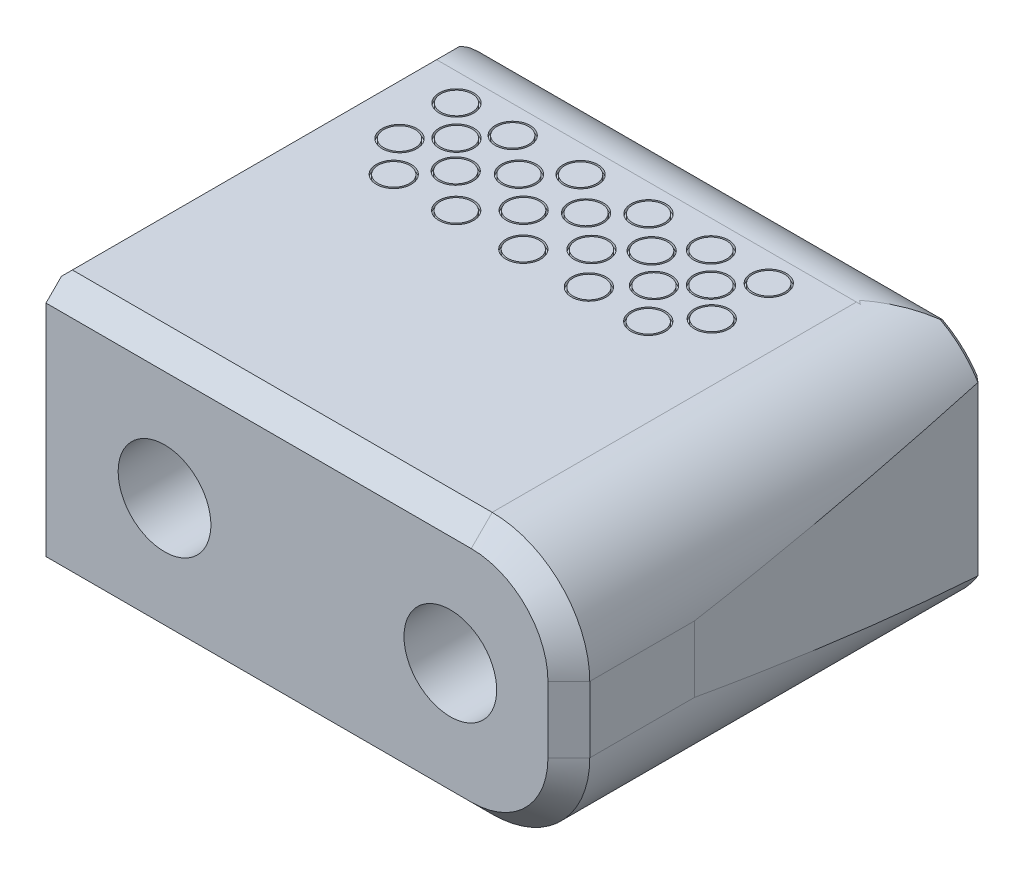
SolidWorks part; units mm, degrees
ref_plane "Front Plane" through (0, 0, 0) normal (0, 0, 1) x (1, 0, 0)
ref_plane "Top Plane" through (0, 0, 0) normal (0, 1, 0) x (1, 0, 0)
ref_plane "Right Plane" through (0, 0, 0) normal (1, 0, 0) x (0, 0, -1)
sketch "Sketch3" plane through (0, 0, 0) normal (1, 0, 0) x (0, 0, -1)
  line L1 (0, -9.525) -> (31.242, -9.525)
  line L2 (0, -9.525) -> (0, 9.525)
  line L3 (0, 9.525) -> (31.242, 9.525)
  line L4 (31.242, -9.525) -> (31.242, 9.525)
  line L6 (0, 0) -> (50000, 0) construction
  dimension "D1" = 31.242
  dimension "D3" = 19.05
extrude "Extrude1" add sketch "Sketch3" along normal blind 38.1
hole_wizard "1/4\"-20 CBORE" positions "Sketch7" profile "Sketch6" counterbore size "1/4" standard "ANSI Inch"
sketch "Sketch7" plane through (0, 0, -31.242) normal (0, 0, -1) x (-1, 0, 0)
  line L0 (0, 0) -> (50000, 0) construction
  line L1 (0, 10.4775) -> (0, -10.4775) construction
  line L3 (-38.1, -9.525) -> (-38.1, 9.525) construction
  point P0 (-8.636, 0)
  point P6 (-29.464, 0)
  dimension "D1" = 8.636
  dimension "D2" = 8.636
sketch "Sketch6" plane through (8.636, 0, -31.242) normal (1, 0, 0) x (0, 1, 0)
  line L0 (0, 0) -> (0, 31.242)
  line L1 (0, 31.242) -> (3.3782, 31.242)
  line L3 (3.3782, 31.242) -> (3.3782, 7.62)
  line L4 (3.3782, 7.62) -> (5.5562, 7.62)
  line L5 (5.5562, 7.62) -> (5.5562, 0)
  line L7 (5.5562, 0) -> (0, 0)
  line L11 (0, -6.35) -> (0, 107.95) construction
  dimension "Thru Hole Dia." = 6.7564
  dimension "Thru Hole Depth" = 31.242
  dimension "C'Bore Dia." = 11.1125
  dimension "C'Bore Depth" = 7.62
fillet "Fillet1" radius 7.112 2 edges at (38.1, -9.525, -15.621) (38.1, 9.525, -15.621)
chamfer "Chamfer1" distance 0.3969 angle 45 5 edges at (15.494, -9.525, -31.242) (36.0169, -7.4419, -31.242) (15.494, 9.525, -31.242) (38.1, 0, -31.242) (36.0169, 7.4419, -31.242)
chamfer "Chamfer2" distance 1.524 angle 45 6 edges at (0, 0, 0) (15.494, -9.525, 0) (36.0169, -7.4419, 0) (38.1, 0, 0) (36.0169, 7.4419, 0) (15.494, 9.525, 0)
sketch "Sketch8" plane through (0, 0, 0) normal (-1, 0, 0) x (0, 0, 1)
  line L0 (0, 0) -> (-50000, 0) construction
  line L2 (-31.242, -8.3763) -> (-40.767, -8.3763)
  line L3 (-28.067, -9.5193) -> (-28.067, -22.2193)
  line L4 (-28.067, -22.2193) -> (-40.767, -22.2193)
  line L5 (-30.8451, 9.525) -> (-1.524, 9.525) construction
  line L6 (-31.242, -9.1281) -> (-31.242, 9.1281) construction
  line L7 (-40.767, -22.2193) -> (-40.767, -8.3763)
  line L10 (-40.767, 22.2193) -> (-40.767, 8.3763)
  line L11 (-28.067, 22.2193) -> (-40.767, 22.2193)
  line L12 (-28.067, 9.5193) -> (-28.067, 22.2193)
  line L13 (-31.242, 8.3763) -> (-40.767, 8.3763)
  arc A4 (-31.242, 8.3763) -> (-28.067, 9.5193) centre (-28.2894, 5.1559) cw
  arc A5 (-31.242, -8.3763) -> (-28.067, -9.5193) centre (-28.2894, -5.1559) ccw
  dimension "D1" = 3.175
  dimension "D2" = 1.143
  dimension "D4" = 12.7
  dimension "D5" = 12.7
extrude "Cut-Extrude2" cut sketch "Sketch8" against normal through all
sketch "Sketch5" plane through (0, 0, 0) normal (0, 1, 0) x (1, 0, 0)
  line L1 (-5.497, 9.144) -> (49994.503, 9.144) construction
  line L3 (-10.4775, 0) -> (10.4775, 0) construction
  line L5 (38.1, 9.144) -> (50.8, 9.144)
  line L6 (50.8, 9.144) -> (50.8, 34.544)
  line L7 (50.8, 34.544) -> (36.6845, 34.544)
  line L8 (38.1, 30.8451) -> (38.1, 1.524) construction
  arc A1 (38.1, 9.144) -> (36.6845, 34.544) centre (-190.5, 9.144) ccw
  dimension "D2" = 228.6
  dimension "D1" = 9.144
  dimension "D3" = 12.7
  dimension "D4" = 25.4
extrude "Cut-Extrude1" cut sketch "Sketch5" against normal mid plane 25
chamfer "Chamfer3" distance 0.3969 angle 45 1 edges at (37.0294, 0, -31.242)
chamfer "Chamfer4" distance 0.3969 angle 45 3 edges at (0, -9.525, -14.7955) (0, 9.525, -14.7955) (0, 0, -31.242)
sketch "Sketch9" plane through (0, 9.525, 0) normal (0, 1, 0) x (1, 0, 0)
  line L0 (0, 0) -> (50000, 0) construction
  circle A0 centre (7.9516, 26.0567) radius 1.27
  circle A1 centre (7.9516, 26.0567) radius 1.143
  circle A2 centre (12.9006, 26.0567) radius 1.27
  circle A3 centre (12.9006, 26.0567) radius 1.143
  circle A4 centre (17.8496, 26.0567) radius 1.27
  circle A5 centre (17.8496, 26.0567) radius 1.143
  circle A6 centre (22.4004, 26.0567) radius 1.27
  circle A7 centre (22.4004, 26.0567) radius 1.143
  circle A8 centre (26.6099, 26.0567) radius 1.27
  circle A9 centre (26.6099, 26.0567) radius 1.143
  circle A10 centre (10.6252, 23.8382) radius 1.27
  circle A11 centre (10.6252, 23.8382) radius 1.143
  circle A12 centre (15.5173, 23.8382) radius 1.27
  circle A13 centre (15.5173, 23.8382) radius 1.143
  circle A14 centre (20.2957, 23.8382) radius 1.27
  circle A15 centre (20.2957, 23.8382) radius 1.143
  circle A16 centre (24.6189, 23.8382) radius 1.27
  circle A17 centre (24.6189, 23.8382) radius 1.143
  circle A18 centre (8.1223, 21.7334) radius 1.27
  circle A19 centre (8.1223, 21.7334) radius 1.143
  circle A20 centre (6.0744, 23.8382) radius 1.27
  circle A21 centre (6.0744, 23.8382) radius 1.143
  circle A22 centre (13.0713, 21.7334) radius 1.27
  circle A23 centre (13.0713, 21.7334) radius 1.143
  circle A24 centre (18.0203, 21.7334) radius 1.27
  circle A25 centre (18.0203, 21.7334) radius 1.143
  circle A26 centre (3.8559, 26.0567) radius 1.27
  circle A27 centre (3.8559, 26.0567) radius 1.143
  circle A28 centre (22.5711, 21.7334) radius 1.27
  circle A29 centre (22.5711, 21.7334) radius 1.143
  circle A30 centre (26.7806, 21.7334) radius 1.27
  circle A31 centre (26.7806, 21.7334) radius 1.143
  circle A32 centre (4.0266, 21.7334) radius 1.27
  circle A33 centre (4.0266, 21.7334) radius 1.143
  circle A34 centre (10.6252, 19.2662) radius 1.27
  circle A35 centre (10.6252, 19.2662) radius 1.143
  circle A36 centre (15.5173, 19.2662) radius 1.27
  circle A37 centre (15.5173, 19.2662) radius 1.143
  circle A38 centre (20.2957, 19.2662) radius 1.27
  circle A39 centre (20.2957, 19.2662) radius 1.143
  circle A40 centre (24.6189, 19.2662) radius 1.27
  circle A41 centre (24.6189, 19.2662) radius 1.143
  circle A42 centre (6.0744, 19.2662) radius 1.27
  circle A43 centre (6.0744, 19.2662) radius 1.143
  dimension "D3" = 2.54
  dimension "D1" = 2
  dimension "D4" = 2.286
extrude "Cut-Extrude3" cut sketch "Sketch9" against normal blind 0.254
mirror "Mirror3" about plane through (0, 0, 0) normal (0, 1, 0) of "Cut-Extrude3"
